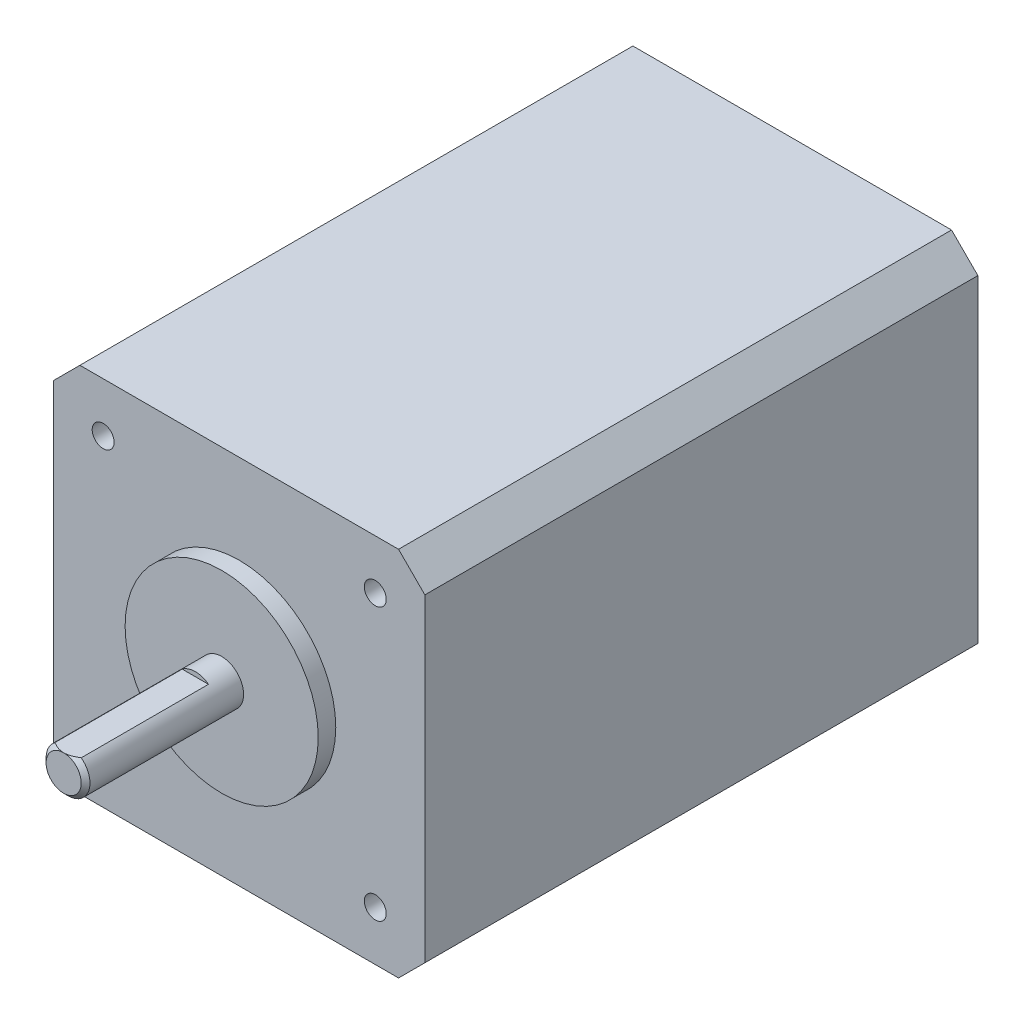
SolidWorks part; units mm, degrees
ref_plane "前视基准面" through (0, 0, 0) normal (0, 0, 1) x (1, 0, 0)
ref_plane "上视基准面" through (0, 0, 0) normal (0, 1, 0) x (1, 0, 0)
ref_plane "右视基准面" through (0, 0, 0) normal (1, 0, 0) x (0, 0, -1)
sketch "草图1" plane through (0, 0, 0) normal (0, 0, 1) x (1, 0, 0)
  circle A0 centre (0, 0) radius 11
extrude "凸台-拉伸1" add sketch "草图1" against normal blind 2
sketch "草图2" plane through (0, 0, 0) normal (0, 0, 1) x (1, 0, 0)
  circle A0 centre (0, 0) radius 2.5
extrude "凸台-拉伸2" add sketch "草图2" along normal blind 18
sketch "草图3" plane through (0, 0, 18) normal (0, 0, 1) x (1, 0, 0)
  line L1 (0, 2) -> (2.8558, 2)
  line L2 (2.8558, 2) -> (2.8558, 3.4127)
  line L3 (2.8558, 3.4127) -> (-2.5, 3.4127)
  line L4 (-2.5, 3.4127) -> (-2.5, 2)
  line L5 (-2.5, 2) -> (0, 2)
extrude "切除-拉伸1" cut sketch "草图3" against normal blind 15
chamfer "倒角1" distance 0.5 angle 45 1 edges at (0, -2.5, 18)
sketch "草图4" plane through (0, 0, -2) normal (0, 0, -1) x (-1, 0, 0)
  line L0 (-21.15, 18.15) -> (-18.15, 21.15)
  line L1 (0, 21.15) -> (18.15, 21.15)
  line L2 (21.15, 18.15) -> (21.15, -18.15)
  line L3 (18.15, -21.15) -> (-18.15, -21.15)
  line L4 (-21.15, -18.15) -> (-21.15, 18.15)
  line L5 (-18.15, 21.15) -> (0, 21.15)
  line L6 (18.15, 21.15) -> (21.15, 18.15)
  line L7 (21.15, -18.15) -> (18.15, -21.15)
  line L8 (-18.15, -21.15) -> (-21.15, -18.15)
  point P3 (21.15, 21.15)
  point P4 (21.15, -21.15)
  point P5 (-21.15, -21.15)
  point P6 (-21.15, 21.15)
extrude "凸台-拉伸3" add sketch "草图4" along normal blind 63
sketch "草图5" plane through (0, 0, -2) normal (0, 0, 1) x (1, 0, 0)
  point P8 (-15.5, 15.5)
  point P9 (15.5, 15.5)
  point P10 (15.5, -15.5)
  point P11 (-15.5, -15.5)
hole_wizard "M3 螺纹孔1" positions "草图7" profile "草图6" tap size "M3" standard "GB"
sketch "草图7" plane through (0, 0, -2) normal (0, 0, 1) x (1, 0, 0)
  point P0 (-15.5, 15.5)
  point P3 (15.5, 15.5)
  point P6 (15.5, -15.5)
  point P9 (-15.5, -15.5)
sketch "草图6" plane through (-15.5, 15.5, -2) normal (1, 0, 0) x (0, -1, 0)
  line L0 (0, 0) -> (0, 7.7511)
  line L1 (0, 7.7511) -> (1.25, 7)
  line L2 (1.25, 7) -> (1.25, 0)
  line L5 (1.25, 0) -> (0, 0)
  line L10 (0, 7.7511) -> (-1.25, 7) construction
  line L11 (0, -6.35) -> (0, 107.95) construction
  dimension "螺纹孔钻头直径" = 2.5
  dimension "螺纹孔钻头深度" = 7
  dimension "导头角度" = 118
